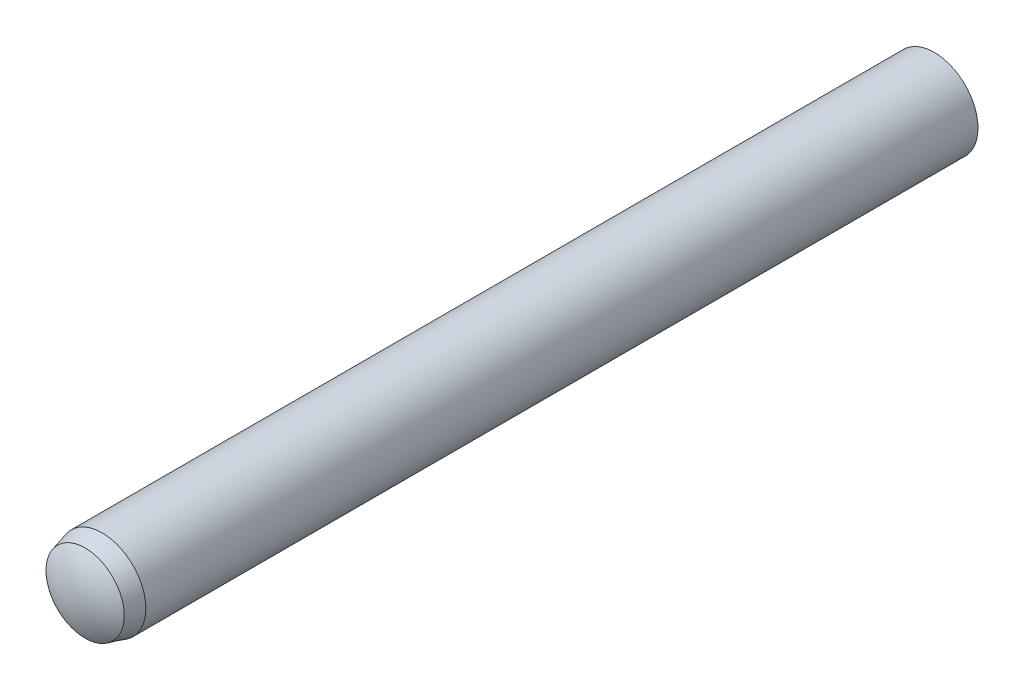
SolidWorks part; units mm, degrees
ref_plane "Front Plane" through (0, 0, 0) normal (0, 0, 1) x (1, 0, 0)
ref_plane "Top Plane" through (0, 0, 0) normal (0, 1, 0) x (1, 0, 0)
ref_plane "Right Plane" through (0, 0, 0) normal (1, 0, 0) x (0, 0, -1)
sketch "Sketch1" plane through (0, 0, 0) normal (0, 0, 1) x (1, 0, 0)
  circle A0 centre (0, 0) radius 2
  point P3 (0, 2)
sketch "Sketch2" plane through (0, 0, 0) normal (1, 0, 0) x (0, 0, -1)
  line L0 (-20, 0) -> (20, 0) construction
  line L1 (-20, 0) -> (-20, 2) construction
  line L2 (-20, 2) -> (20, 2)
  line L3 (20, 2) -> (20, 0) construction
  line L4 (-19.48, 1.791) -> (-18.7, 2)
  arc A0 (-20, 0) -> (-19.48, 1.791) centre (-16.6557, 0) cw
  arc A1 (20, 0) -> (19.4, 2) centre (16.3667, 0) ccw
  point P2 (0, 0)
  point P11 (-16, 0)
  point P13 (16, 0)
sketch "Sketch3" plane through (0, 0, 0) normal (1, 0, 0) x (0, 0, -1)
  line L0 (-20, 0) -> (20, 0) construction
  line L1 (-19.48, 1.791) -> (-18.7, 2) construction
  line L2 (-20, 0) -> (20, 0)
  line L3 (-19.48, 1.791) -> (-18.7, 2)
  line L4 (-18.7, 2) -> (19.4, 2)
  arc A0 (20, 0) -> (19.4, 2) centre (16.3667, 0) ccw construction
  arc A1 (-19.48, 1.791) -> (-20, 0) centre (-16.6557, 0) ccw construction
  arc A2 (20, 0) -> (19.4, 2) centre (16.3667, 0) ccw
  arc A3 (-19.48, 1.791) -> (-20, 0) centre (-16.6557, 0) ccw
revolve "Revolve1" add sketch "Sketch3" angle 360 about L2
equation "\"D2@Sketch2\" = \"Diameter@Sketch1\" * .15"
equation "\"D3@Sketch2\" = \"Diameter@Sketch1\" * .325"
equation "\"D4@Sketch2\" = \"D3@Sketch2\" * .6"
equation "\"D5@Sketch2\"=\"Diameter@Sketch1\""
equation "\"D6@Sketch2\"=\"D5@sketch2\""
